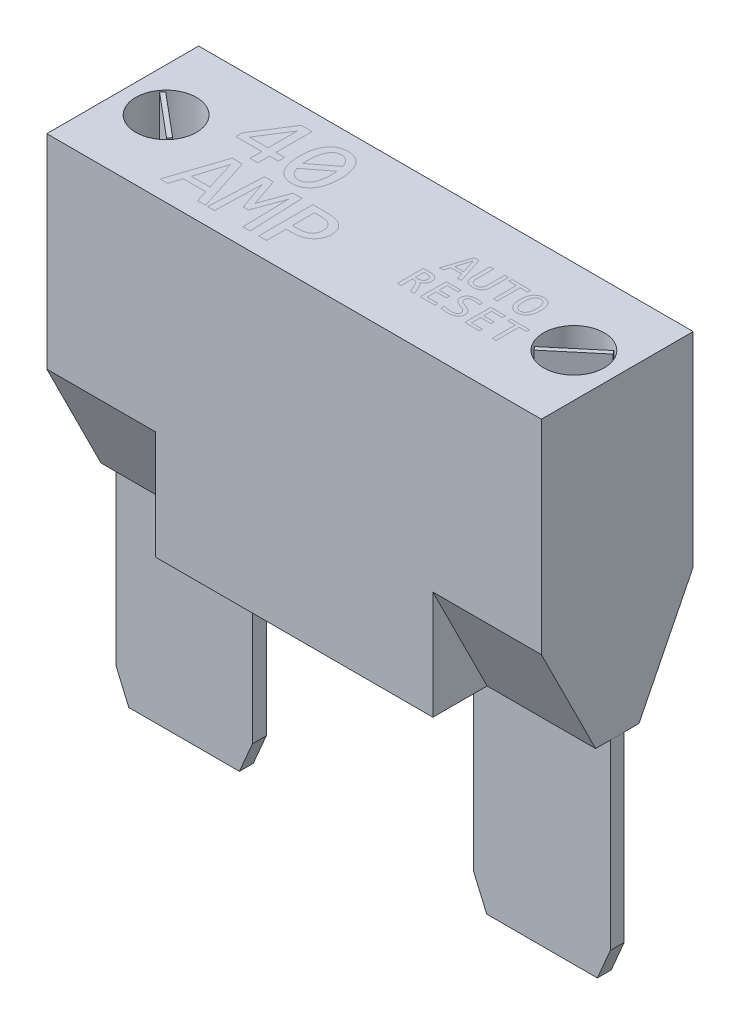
SolidWorks part; units mm, degrees
ref_plane "Front Plane" through (0, 0, 0) normal (0, 0, 1) x (1, 0, 0)
ref_plane "Top Plane" through (0, 0, 0) normal (0, 1, 0) x (1, 0, 0)
ref_plane "Right Plane" through (0, 0, 0) normal (1, 0, 0) x (0, 0, -1)
sketch "Sketch1" plane through (0, 0, 0) normal (0, 1, 0) x (1, 0, 0)
  line L1 (-6.477, 0.4064) -> (-14.478, 0.4064)
  line L2 (-6.477, 0.4064) -> (-6.477, -0.4064)
  line L3 (-6.477, -0.4064) -> (-14.478, -0.4064)
  line L4 (-14.478, 0.4064) -> (-14.478, -0.4064)
  line L5 (-6.477, 0.4064) -> (-14.478, -0.4064) construction
  line L6 (-6.477, -0.4064) -> (-14.478, 0.4064) construction
  line L7 (14.478, 0.4064) -> (6.477, 0.4064)
  line L8 (14.478, 0.4064) -> (14.478, -0.4064)
  line L9 (14.478, -0.4064) -> (6.477, -0.4064)
  line L10 (6.477, 0.4064) -> (6.477, -0.4064)
  line L11 (14.478, 0.4064) -> (6.477, -0.4064) construction
  line L12 (14.478, -0.4064) -> (6.477, 0.4064) construction
  point P0 (-10.4775, 0)
  point P5 (10.4775, 0)
  dimension "D1" = 0.8128
  dimension "D2" = 0.8128
  dimension "D3" = 12.954
  dimension "D4" = 6.477
  dimension "D5" = 8.001
  dimension "D6" = 8.001
extrude "Boss-Extrude1" add sketch "Sketch1" against normal blind 12.446
sketch "Sketch6" plane through (0, 0, 0.4064) normal (0, 0, 1) x (1, 0, 0)
  line L0 (-14.478, -10.668) -> (-13.716, -12.446)
  line L1 (-14.478, -12.446) -> (-14.478, 0) construction
  line L2 (-14.478, -12.446) -> (-6.477, -12.446) construction
  line L3 (-13.716, -12.446) -> (-14.478, -12.446)
  line L4 (-14.478, -12.446) -> (-14.478, -10.668)
  line L5 (-6.477, -10.668) -> (-7.239, -12.446)
  line L6 (-6.477, -12.446) -> (-6.477, 0) construction
  line L7 (-7.239, -12.446) -> (-6.477, -12.446)
  line L8 (-6.477, -12.446) -> (-6.477, -10.668)
  line L9 (6.477, -12.446) -> (6.477, -10.668)
  line L11 (6.477, -12.446) -> (6.477, 0) construction
  line L12 (6.477, -12.446) -> (14.478, -12.446) construction
  line L13 (7.239, -12.446) -> (6.477, -12.446)
  line L14 (6.477, -10.668) -> (7.239, -12.446)
  line L15 (14.478, -10.668) -> (13.716, -12.446)
  line L16 (14.478, -12.446) -> (14.478, 0) construction
  line L17 (13.716, -12.446) -> (14.478, -12.446)
  line L18 (14.478, -12.446) -> (14.478, -10.668)
  dimension "D1" = 1.778
  dimension "D2" = 1.778
  dimension "D3" = 0.762
  dimension "D4" = 0.762
  dimension "D5" = 0.762
  dimension "D6" = 1.778
  dimension "D7" = 1.778
  dimension "D8" = 0.762
extrude "Cut-Extrude8" cut sketch "Sketch6" against normal blind 0.8128
sketch "Sketch7" plane through (0, 0, 0) normal (0, 1, 0) x (1, 0, 0)
  line L1 (14.478, 4.445) -> (-14.478, 4.445)
  line L2 (14.478, 4.445) -> (14.478, -4.445)
  line L3 (14.478, -4.445) -> (-14.478, -4.445)
  line L4 (-14.478, 4.445) -> (-14.478, -4.445)
  line L5 (14.478, 4.445) -> (-14.478, -4.445) construction
  line L6 (14.478, -4.445) -> (-14.478, 4.445) construction
  point P0 (0, 0)
  dimension "D1" = 8.89
  dimension "D2" = 28.956
extrude "Boss-Extrude2" add sketch "Sketch7" along normal blind 18.288 separate body
sketch "Sketch8" plane through (14.478, 0, 0) normal (1, 0, 0) x (0, 0, -1)
  line L0 (-4.445, 6.35) -> (-1.27, 0)
  line L1 (-4.445, 18.288) -> (-4.445, 0) construction
  line L2 (-4.445, 0) -> (4.445, 0) construction
  line L3 (-1.27, 0) -> (-4.445, 0)
  line L4 (-4.445, 0) -> (-4.445, 6.35)
  line L5 (4.445, 6.35) -> (1.27, 0)
  line L6 (4.445, 18.288) -> (4.445, 0) construction
  line L7 (1.27, 0) -> (4.445, 0)
  line L8 (4.445, 0) -> (4.445, 6.35)
  dimension "D1" = 6.35
  dimension "D2" = 6.35
  dimension "D3" = 3.175
  dimension "D4" = 3.175
extrude "Cut-Extrude9" cut sketch "Sketch8" against normal blind 6.35
sketch "Sketch9" plane through (-14.478, 0, 0) normal (-1, 0, 0) x (0, 0, 1)
  line L0 (-4.445, 6.35) -> (-1.27, 0)
  line L1 (-4.445, 18.288) -> (-4.445, 0) construction
  line L2 (-4.445, 0) -> (4.445, 0) construction
  line L3 (-1.27, 0) -> (-4.445, 0)
  line L4 (-4.445, 0) -> (-4.445, 6.35)
  line L5 (4.445, 18.288) -> (4.445, 0) construction
  line L6 (4.445, 6.35) -> (1.27, 0)
  line L7 (1.27, 0) -> (4.445, 0)
  line L8 (4.445, 0) -> (4.445, 6.35)
  dimension "D1" = 6.35
  dimension "D2" = 3.175
  dimension "D3" = 3.175
  dimension "D4" = 6.35
extrude "Cut-Extrude10" cut sketch "Sketch9" against normal blind 6.35
sketch "Sketch10" plane through (0, 18.288, 0) normal (0, 1, 0) x (1, 0, 0)
  line L0 (-14.478, 4.445) -> (-14.478, -4.445) construction
  line L1 (14.478, -4.445) -> (14.478, 4.445) construction
  circle A0 centre (-11.938, 0) radius 1.778
  circle A1 centre (11.938, 0) radius 1.778
  dimension "D1" = 3.556
  dimension "D2" = 3.556
  dimension "D3" = 2.54
  dimension "D4" = 2.54
extrude "Cut-Extrude11" cut sketch "Sketch10" against normal blind 2.54
sketch "Sketch11" plane through (0, 18.288, 0) normal (0, 1, 0) x (1, 0, 0)
  line L0 (-13.2844, 0.964) -> (-10.7549, -1.1585)
  line L1 (-13.2844, 0.964) -> (-13.1211, 1.1585)
  line L2 (-10.7549, -1.1585) -> (-10.5916, -0.964)
  line L3 (-13.1211, 1.1585) -> (-10.5916, -0.964)
  line L4 (-13.2844, 0.964) -> (-10.5916, -0.964) construction
  line L5 (-10.7549, -1.1585) -> (-13.1211, 1.1585) construction
  line L6 (13.2806, 0.9608) -> (10.7586, -1.1554)
  line L7 (13.2806, 0.9608) -> (13.1174, 1.1554)
  line L8 (10.7586, -1.1554) -> (10.5954, -0.9608)
  line L9 (13.1174, 1.1554) -> (10.5954, -0.9608)
  line L10 (13.2806, 0.9608) -> (10.5954, -0.9608) construction
  line L11 (10.7586, -1.1554) -> (13.1174, 1.1554) construction
  line L12 (-14.478, -4.445) -> (14.478, -4.445) construction
  point P1 (-11.938, 0)
  point P2 (11.938, 0)
  dimension "D1" = 0.254
  dimension "D2" = 11.938
  dimension "D3" = 11.938
  dimension "D4" = 40
  dimension "D5" = 40
  dimension "D6" = 0
  dimension "D7" = 3.302
  dimension "D8" = 0.254
  dimension "D9" = 3.302
extrude "Boss-Extrude3" add sketch "Sketch11" against normal blind 2.54
sketch "Sketch12" plane through (0, 18.288, 0) normal (0, 1, 0) x (1, 0, 0)
  text T0 "40" font "Consolas" height 3.175
  text T1 "AMP" font "Consolas" height 3.175
  text T2 "AUTO" font "Consolas" height 1.524
  text T3 "RESET" font "Consolas" height 1.524
  dimension "D1" = 8.89
  dimension "D2" = 0.254
  dimension "D3" = 3.429
  dimension "D4" = 8.89
  dimension "D5" = 3.81
  dimension "D6" = 0.254
  dimension "D7" = 1.778
  dimension "D8" = 3.175
extrude "Cut-Extrude12" cut sketch "Sketch12" against normal blind 0.0254
sketch "Sketch13" plane through (0, 18.288, 0) normal (0, 1, 0) x (1, 0, 0)
  text T0 "40" font "Consolas" height 3.175
  text T1 "AMP" font "Consolas" height 3.175
  text T2 "AUTO" font "Consolas" height 1.524
  text T3 "RESET" font "Consolas" height 1.524
  point P7 (0, 0)
  dimension "D1" = 8.89
  dimension "D2" = 0.254
  dimension "D3" = 3.429
  dimension "D4" = 8.89
  dimension "D5" = 0.254
  dimension "D6" = 1.778
  dimension "D7" = 3.81
  dimension "D8" = 3.175
extrude "Boss-Extrude4" add sketch "Sketch13" against normal blind 0.0254 separate body
equation "\".001n\"=0.1"
